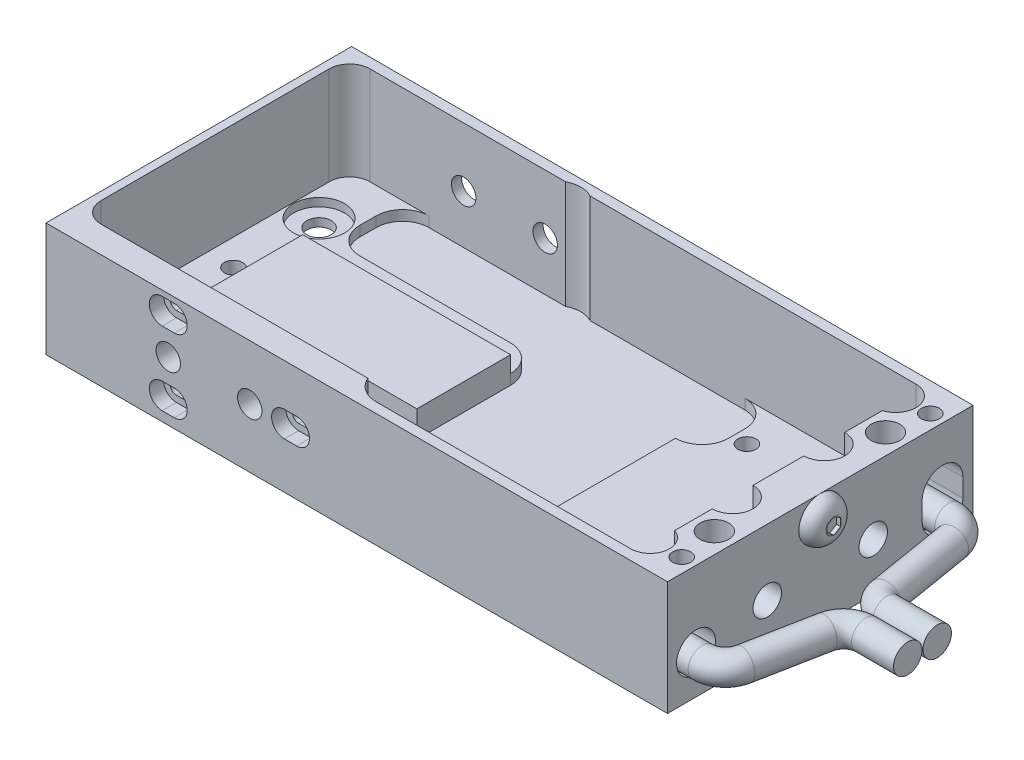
SolidWorks part; units mm, degrees
ref_plane "Front Plane" through (0, 0, 0) normal (0, 0, 1) x (1, 0, 0)
ref_plane "Top Plane" through (0, 0, 0) normal (0, 1, 0) x (1, 0, 0)
ref_plane "Right Plane" through (0, 0, 0) normal (1, 0, 0) x (0, 0, -1)
sketch "Sketch1" plane through (0, 0, 0) normal (0, 1, 0) x (1, 0, 0)
  line L1 (0, 0) -> (77.47, 0)
  line L2 (0, 0) -> (0, 38.1)
  line L3 (0, 38.1) -> (77.47, 38.1)
  line L4 (77.47, 0) -> (77.47, 38.1)
  dimension "D1" = 38.1
  dimension "D2" = 77.47
extrude "Base" add sketch "Sketch1" against normal blind 14.224
sketch "Hole Locations" plane through (0, 0, 0) normal (0, 1, 0) x (1, 0, 0)
  line L0 (0, 19.05) -> (75.692, 19.05) construction
  line L1 (0, 38.1) -> (0, 0) construction
  line L3 (4.318, 19.05) -> (4.318, 0) construction
  line L4 (0, 0) -> (77.47, 0) construction
  line L5 (11.43, 19.05) -> (11.43, 0) construction
  line L6 (30.48, 19.05) -> (30.48, 0) construction
  line L7 (55.372, 32.004) -> (55.372, 19.05) construction
  line L8 (55.372, 19.05) -> (55.372, 6.096) construction
  line L9 (69.596, 19.05) -> (69.596, 8.382) construction
  line L10 (69.596, 19.05) -> (69.596, 29.718) construction
  line L11 (75.692, 34.544) -> (75.692, 3.556) construction
  dimension "D1" = 19.05
  dimension "D2" = 4.318
  dimension "D3" = 11.43
  dimension "D4" = 30.48
  dimension "D5" = 55.372
  dimension "D6" = 6.096
  dimension "D7" = 69.596
  dimension "D8" = 8.382
  dimension "D9" = 75.692
  dimension "D10" = 3.556
hole_wizard "#4-40 Tapped Hole1" positions "3DSketch1" profile "Sketch3" tap size "#4-40" standard "Ansi Inch"
sketch3d "3DSketch1"
  point P0 (4.318, 0, -19.05)
  point P3 (11.43, 0, -19.05)
  point P6 (30.48, 0, -19.05)
  point P9 (55.372, 0, -32.004)
  point P12 (55.372, 0, -6.096)
  point P15 (69.596, 0, -29.718)
  point P18 (69.596, 0, -8.382)
  point P21 (75.692, 0, -3.556)
  point P24 (75.692, 0, -34.544)
sketch "Sketch3" plane through (4.318, 0, -19.05) normal (1, 0, 0) x (0, 0, 1)
  line L0 (0, 0) -> (0, 14.224)
  line L1 (0, 14.224) -> (1.1303, 14.224)
  line L2 (1.1303, 14.224) -> (1.1303, 0)
  line L5 (1.1303, 0) -> (0, 0)
  line L11 (0, -6.35) -> (0, 107.95) construction
  dimension "Thru Tap Drill Dia." = 2.2606
  dimension "Thru Tap Drill Depth" = 14.224
sketch "Sketch4" plane through (0, 0, 0) normal (0, 1, 0) x (1, 0, 0)
  line L1 (0, 0) -> (77.47, 0) construction
  circle A0 centre (74.93, 29.718) radius 1.778
  circle A1 centre (74.93, 8.382) radius 1.778
  dimension "D1" = 3.556
  dimension "D2" = 8.382
  dimension "D3" = 29.718
  dimension "D4" = 74.93
extrude "2 Thru Holes" cut sketch "Sketch4" against normal through all
sketch "Sketch5" plane through (0, 0, 0) normal (0, 1, 0) x (1, 0, 0)
  line L0 (50.292, 1.27) -> (39.878, 1.27)
  line L1 (7.62, 31.496) -> (7.62, 6.604) construction
  line L2 (10.922, 9.906) -> (29.718, 9.906)
  line L3 (33.02, 13.208) -> (33.02, 24.892)
  line L4 (29.718, 28.194) -> (10.922, 28.194)
  line L5 (7.62, 31.496) -> (7.62, 33.528)
  line L6 (10.922, 36.83) -> (27.9242, 36.83)
  line L7 (31.0038, 36.83) -> (50.292, 36.83)
  line L8 (53.594, 33.528) -> (53.594, 31.496)
  line L9 (50.292, 28.194) -> (50.292, 9.906)
  line L10 (53.594, 6.604) -> (53.594, 4.572)
  line L11 (27.9242, 36.83) -> (31.0038, 36.83) construction
  line L12 (29.464, 36.83) -> (29.464, 37.211) construction
  line L13 (36.83, 3.302) -> (10.922, 3.302)
  line L14 (0, 0) -> (77.47, 0) construction
  line L15 (0, 38.1) -> (0, 0) construction
  arc A0 (10.922, 3.302) -> (10.922, 9.906) centre (10.922, 6.604) cw
  arc A2 (29.718, 9.906) -> (33.02, 13.208) centre (29.718, 13.208) ccw
  arc A3 (33.02, 24.892) -> (29.718, 28.194) centre (29.718, 24.892) ccw
  arc A4 (10.922, 28.194) -> (7.62, 31.496) centre (10.922, 31.496) cw
  arc A5 (7.62, 33.528) -> (10.922, 36.83) centre (10.922, 33.528) cw
  arc A6 (27.9242, 36.83) -> (31.0038, 36.83) centre (29.464, 33.909) cw
  arc A7 (50.292, 36.83) -> (53.594, 33.528) centre (50.292, 33.528) cw
  arc A8 (53.594, 31.496) -> (50.292, 28.194) centre (50.292, 31.496) cw
  arc A9 (50.292, 9.906) -> (53.594, 6.604) centre (50.292, 6.604) cw
  arc A10 (53.594, 4.572) -> (50.292, 1.27) centre (50.292, 4.572) cw
  arc A11 (39.878, 1.27) -> (36.83, 3.302) centre (39.878, 4.572) cw
  dimension "D3" = 3.302
  dimension "D1" = 0.381
  dimension "D2" = 29.464
  dimension "D4" = 1.27
  dimension "D5" = 3.302
  dimension "D6" = 9.906
  dimension "D7" = 28.194
  dimension "D8" = 36.83
  dimension "D9" = 10.922
  dimension "D10" = 50.292
  dimension "D11" = 33.02
  dimension "D12" = 36.83
extrude "0.53 DP" cut sketch "Sketch5" against normal blind 13.462
sketch "Sketch6" plane through (0, 0, 0) normal (0, 1, 0) x (1, 0, 0)
  line L0 (50.292, 36.83) -> (71.628, 36.83)
  line L1 (71.628, 31.75) -> (65.786, 31.75)
  line L2 (65.786, 31.75) -> (65.786, 27.178)
  line L3 (65.786, 27.178) -> (72.39, 27.178)
  line L4 (72.39, 22.098) -> (72.39, 15.748)
  line L5 (72.39, 10.668) -> (65.786, 10.668)
  line L6 (65.786, 10.668) -> (65.786, 6.096)
  line L7 (65.786, 6.096) -> (71.628, 6.096)
  line L8 (71.628, 1.27) -> (50.292, 1.27)
  line L9 (50.292, 1.27) -> (50.292, 36.83)
  line L10 (0, 0) -> (77.47, 0) construction
  line L11 (65.786, 8.382) -> (77.47, 8.382) construction
  line L12 (77.47, 0) -> (77.47, 38.1) construction
  line L13 (10.922, 36.83) -> (3.556, 36.83)
  line L14 (1.016, 34.29) -> (1.016, 5.842)
  line L15 (3.556, 3.302) -> (36.83, 3.302)
  line L17 (0, 38.1) -> (0, 0) construction
  line L18 (10.922, 36.83) -> (36.83, 36.83)
  line L19 (50.292, 36.83) -> (31.0038, 36.83) construction
  line L20 (36.83, 36.83) -> (36.83, 3.302)
  arc A0 (71.628, 36.83) -> (71.628, 31.75) centre (71.628, 34.29) cw
  arc A1 (72.39, 27.178) -> (72.39, 22.098) centre (72.39, 24.638) cw
  arc A2 (72.39, 10.668) -> (72.39, 15.748) centre (72.39, 13.208) ccw
  arc A3 (71.628, 6.096) -> (71.628, 1.27) centre (71.628, 3.683) cw
  arc A4 (3.556, 36.83) -> (1.016, 34.29) centre (3.556, 34.29) ccw
  arc A5 (1.016, 5.842) -> (3.556, 3.302) centre (3.556, 5.842) ccw
  dimension "D1" = 2.54
  dimension "D2" = 72.39
  dimension "D3" = 65.786
  dimension "D4" = 6.096
  dimension "D5" = 71.628
  dimension "D6" = 8.382
  dimension "D7" = 1.016
extrude "0.48 DP" cut sketch "Sketch6" against normal blind 12.192
sketch "Sketch7" plane through (0, -12.192, 0) normal (0, 1, 0) x (1, 0, 0)
  line L0 (33.02, 13.208) -> (33.02, 24.892) construction
  line L1 (7.112, 24.892) -> (33.02, 24.892)
  line L2 (7.112, 24.892) -> (7.112, 13.208)
  line L3 (7.112, 13.208) -> (33.02, 13.208)
  line L4 (33.02, 24.892) -> (33.02, 13.208)
  dimension "D1" = 7.112
extrude "0.40 DP" add sketch "Sketch7" along normal blind 2.032
sketch "CB Locations" plane through (0, 0, 0) normal (0, 1, 0) x (1, 0, 0)
  line L0 (4.318, 19.05) -> (4.318, 29.718) construction
  line L1 (4.318, 19.05) -> (4.318, 8.382) construction
  dimension "D1" = 4.318
  dimension "D2" = 8.382
  dimension "D3" = 29.718
hole_wizard "Counterbores" positions "Sketch9" profile "Sketch8" legacy
sketch "Sketch9" plane through (-3.447, 0, -18.161) normal (0, 1, 0) x (-1, 0, 0)
  point P0 (-7.765, -11.557)
  point P4 (-7.765, 9.779)
sketch "Sketch8" plane through (4.318, 0, -29.718) normal (1, 0, 0) x (0, 0, 1)
  line L0 (0, 0) -> (0, 14.224)
  line L1 (0, 14.224) -> (1.524, 14.224)
  line L2 (1.524, 14.224) -> (1.524, 13.208)
  line L3 (1.524, 13.208) -> (3.175, 13.208)
  line L4 (3.175, 13.208) -> (3.175, 0)
  line L5 (3.175, 0) -> (0, 0)
  line L6 (0, 110) -> (0, -10) construction
  dimension "Diameter" = 3.048
  dimension "Depth" = 14.224
  dimension "C-Bore Diameter" = 6.35
  dimension "C-Bore Depth" = 13.208
sketch "Sketch11" plane through (0, 0, 0) normal (0, 1, 0) x (-1, 0, 0)
  line L0 (-72.39, -15.748) -> (-72.39, -22.098) construction
  line L1 (-65.786, -31.867) -> (-72.39, -31.867)
  line L2 (-65.786, -31.867) -> (-65.786, -5.9725)
  line L3 (-65.786, -5.9725) -> (-72.39, -5.9725)
  line L4 (-72.39, -31.867) -> (-72.39, -5.9725)
  line L5 (-65.786, -27.178) -> (-65.786, -31.75) construction
  arc A1 (-71.628, -1.27) -> (-71.628, -6.096) centre (-71.628, -3.683) ccw construction
  arc A2 (-71.628, -31.75) -> (-71.628, -36.83) centre (-71.628, -34.29) ccw construction
extrude "Shelf 0.40 DP" cut sketch "Sketch11" against normal blind 10.16
sketch "Sketch12" plane through (0, 0, -38.1) normal (0, 0, -1) x (-1, 0, 0)
  circle A0 centre (-15.24, -7.366) radius 1.524
  circle A1 centre (-25.4, -7.366) radius 1.524
  dimension "D1" = 3.048
  dimension "D2" = 7.366
  dimension "D3" = 15.24
  dimension "D4" = 25.4
extrude "2 Side Holes" cut sketch "Sketch12" against normal up to next
sketch "Sketch13" plane through (0, 0, 0) normal (0, 0, 1) x (1, 0, 0)
  line L0 (29.718, -6.858) -> (31.242, -6.858) construction
  line L1 (29.718, -6.0579) -> (31.242, -6.0579)
  line L2 (29.718, -7.6581) -> (31.242, -7.6581)
  line L3 (15.24, -6.858) -> (25.4, -6.858) construction
  line L4 (14.478, -2.286) -> (16.002, -2.286) construction
  line L5 (14.478, -1.4859) -> (16.002, -1.4859)
  line L6 (14.478, -3.0861) -> (16.002, -3.0861)
  line L7 (14.478, -11.43) -> (16.002, -11.43) construction
  line L8 (14.478, -10.6299) -> (16.002, -10.6299)
  line L9 (14.478, -12.2301) -> (16.002, -12.2301)
  line L10 (25.4, -6.858) -> (29.718, -6.858) construction
  line L11 (15.24, -2.286) -> (15.24, -6.858) construction
  line L15 (0, 0) -> (0, -14.224) construction
  line L17 (15.24, -6.858) -> (15.24, -11.43) construction
  arc A0 (29.718, -6.0579) -> (29.718, -7.6581) centre (29.718, -6.858) ccw
  arc A1 (31.242, -7.6581) -> (31.242, -6.0579) centre (31.242, -6.858) ccw
  arc A2 (14.478, -1.4859) -> (14.478, -3.0861) centre (14.478, -2.286) ccw
  arc A3 (16.002, -3.0861) -> (16.002, -1.4859) centre (16.002, -2.286) ccw
  arc A4 (14.478, -10.6299) -> (14.478, -12.2301) centre (14.478, -11.43) ccw
  arc A5 (16.002, -12.2301) -> (16.002, -10.6299) centre (16.002, -11.43) ccw
  circle A6 centre (25.4, -6.858) radius 1.524
  circle A7 centre (15.24, -6.858) radius 1.524
  circle A8 centre (15.24, -7.366) radius 1.524 construction
  point P2 (30.48, -6.858)
  point P13 (15.24, -2.286)
  point P20 (15.24, -11.43)
  dimension "D1" = 0.8001
  dimension "D2" = 1.524
  dimension "D3" = 30.48
  dimension "D4" = 2.286
  dimension "D5" = 11.43
  dimension "D6" = 14.224
  dimension "D7" = 6.858
  dimension "D8" = 15.24
  dimension "D9" = 25.4
extrude "5 Side Holes" cut sketch "Sketch13" against normal up to next
sketch "Sketch14" plane through (0, 0, 0) normal (0, 0, 1) x (1, 0, 0)
  line L0 (14.478, -2.286) -> (16.002, -2.286) construction
  line L1 (14.478, -0.6858) -> (16.002, -0.6858)
  line L2 (14.478, -3.8862) -> (16.002, -3.8862)
  line L3 (14.478, -11.43) -> (16.002, -11.43) construction
  line L4 (14.478, -9.8298) -> (16.002, -9.8298)
  line L5 (14.478, -13.0302) -> (16.002, -13.0302)
  line L6 (29.718, -6.858) -> (31.242, -6.858) construction
  line L7 (29.718, -5.2578) -> (31.242, -5.2578)
  line L8 (29.718, -8.4582) -> (31.242, -8.4582)
  arc A0 (14.478, -0.6858) -> (14.478, -3.8862) centre (14.478, -2.286) ccw
  arc A1 (16.002, -3.8862) -> (16.002, -0.6858) centre (16.002, -2.286) ccw
  arc A2 (16.002, -3.0861) -> (16.002, -1.4859) centre (16.002, -2.286) ccw construction
  arc A3 (14.478, -9.8298) -> (14.478, -13.0302) centre (14.478, -11.43) ccw
  arc A4 (16.002, -13.0302) -> (16.002, -9.8298) centre (16.002, -11.43) ccw
  arc A5 (14.478, -10.6299) -> (14.478, -12.2301) centre (14.478, -11.43) ccw construction
  arc A6 (16.002, -12.2301) -> (16.002, -10.6299) centre (16.002, -11.43) ccw construction
  arc A7 (29.718, -5.2578) -> (29.718, -8.4582) centre (29.718, -6.858) ccw
  arc A8 (31.242, -8.4582) -> (31.242, -5.2578) centre (31.242, -6.858) ccw
  arc A9 (31.242, -7.6581) -> (31.242, -6.0579) centre (31.242, -6.858) ccw construction
  arc A10 (29.718, -6.0579) -> (29.718, -7.6581) centre (29.718, -6.858) ccw construction
  point P3 (15.24, -2.286)
  point P13 (15.24, -11.43)
  point P26 (30.48, -6.858)
  dimension "D1" = 1.6002
  dimension "D2" = 1.6002
  dimension "D3" = 1.6002
extrude "Slot CBs" cut sketch "Sketch14" against normal blind 1.778
sketch "Sketch15" plane through (77.47, 0, 0) normal (1, 0, 0) x (0, 0, -1)
  line L0 (34.29, -7.112) -> (34.29, -9.398) construction
  line L1 (36.83, -7.112) -> (36.83, -9.398)
  line L2 (31.75, -7.112) -> (31.75, -9.398)
  line L3 (34.29, -4.572) -> (43.6694, -4.572) construction
  line L4 (43.6694, -4.572) -> (43.6694, -11.938) construction
  line L5 (43.6694, -11.938) -> (34.29, -11.938) construction
  line L6 (0, 0) -> (38.1, 0) construction
  arc A0 (36.83, -7.112) -> (31.75, -7.112) centre (34.29, -7.112) ccw
  arc A1 (31.75, -9.398) -> (36.83, -9.398) centre (34.29, -9.398) ccw
  circle A2 centre (25.654, -8.255) radius 1.778
  circle A3 centre (12.446, -8.255) radius 1.778
  circle A4 centre (3.556, -9.398) radius 2.4257
  point P2 (34.29, -8.255)
  dimension "D1" = 2.54
  dimension "D9" = 3.556
  dimension "D10" = 4.8514
  dimension "D2" = 4.572
  dimension "D3" = 11.938
  dimension "D4" = 8.255
  dimension "D5" = 31.75
  dimension "D6" = 36.83
  dimension "D7" = 25.654
  dimension "D8" = 12.446
  dimension "D11" = 3.556
  dimension "D12" = 9.398
extrude "Short Side Thrus" cut sketch "Sketch15" against normal blind 6.096
sketch3d "3DSketch4"
  line L0 (0, 0, -19.05) -> (77.47, 0, -19.05) construction
  line L1 (0, 0, -38.1) -> (0, 0, 0) construction
  line L2 (77.47, 0, 0) -> (77.47, 0, -38.1) construction
sketch "Sketch16" plane through (0, 0, -19.05) normal (0, 0, 1) x (1, 0, 0)
  line L0 (77.47, 0) -> (77.47, -2.6734)
  line L1 (79.1523, -1.6823) -> (79.1523, -2.6734)
  line L4 (77.47, -2.6734) -> (80.1699, -2.6734) construction
  line L5 (79.248, 0.254) -> (77.47, 0.254) construction
  line L6 (77.47, 0.254) -> (77.47, 0) construction
  line L7 (77.47, -2.6734) -> (79.1523, -2.6734)
  arc A0 (77.47, 0) -> (79.1523, -1.6823) centre (77.47, -1.6823) cw
revolve "Screw" add sketch "Sketch16" angle 360 about L4
sketch "Sketch17" plane through (79.1523, 0, 0) normal (1, 0, 0) x (0, 0, -1)
  line L1 (19.9083, -3.1689) -> (19.9083, -2.1778)
  line L2 (19.9083, -2.1778) -> (19.05, -1.6823)
  line L3 (19.05, -1.6823) -> (18.1917, -2.1778)
  line L4 (18.1917, -2.1778) -> (18.1917, -3.1689)
  line L5 (18.1917, -3.1689) -> (19.05, -3.6644)
  line L6 (19.05, -3.6644) -> (19.9083, -3.1689)
  circle A0 centre (19.05, -2.6734) radius 0.8583 construction
  circle A1 centre (19.05, -2.6734) radius 0.9911 construction
extrude "Screw Hex" cut sketch "Sketch17" against normal blind 0.508
sketch "Sketch18" plane through (0, -14.224, 0) normal (0, -1, 0) x (1, 0, 0)
  line L0 (77.47, -34.4322) -> (78.2599, -34.4322)
  line L1 (77.47, -19.05) -> (77.47, -38.1) construction
  line L2 (81.0732, -32.0463) -> (82.739, -21.9842)
  line L3 (84.4286, -20.5514) -> (90.6885, -20.5514)
  line L4 (77.47, -34.4322) -> (65.786, -34.4322)
  line L5 (65.786, -34.4322) -> (65.786, -31.75) construction
  arc A0 (78.2599, -34.4322) -> (81.0732, -32.0463) centre (78.2599, -31.5805) ccw
  arc A1 (82.739, -21.9842) -> (84.4286, -20.5514) centre (84.4286, -22.264) cw
sketch "Sketch19" plane through (72.39, 0, 0) normal (-1, 0, 0) x (0, 0, 1)
  line L0 (-34.29, -12.192) -> (-34.29, 0) construction
  circle A0 centre (-34.29, -10.0311) radius 1.778
  dimension "D1" = 3.556
sweep "Cord" add profiles "Sketch19" path "Sketch18"
sketch "Sketch21" plane through (72.39, 0, 0) normal (-1, 0, 0) x (0, 0, 1)
  line L0 (-3.5674, -8.2531) -> (-20.4092, -8.2531) construction
  circle A0 centre (-3.5674, -10.0312) radius 1.7781
  circle A1 centre (-20.4092, -10.0311) radius 1.778 construction
sketch "Sketch20" plane through (0, -14.224, 0) normal (0, -1, 0) x (1, 0, 0)
  line L0 (85.4663, -16.7385) -> (90.6885, -16.7385)
  line L2 (90.6885, -22.1872) -> (90.6885, -18.6312) construction
  line L3 (78.2599, -3.5674) -> (65.786, -3.5674)
  line L4 (65.786, -3.5674) -> (65.786, -1.6009) construction
  line L5 (65.786, -6.096) -> (65.786, -10.668) construction
  line L6 (82.739, -14.4887) -> (81.0732, -5.8882)
  arc A0 (81.0732, -5.8882) -> (78.2599, -3.5674) centre (78.2599, -6.4331) ccw
  arc A1 (82.739, -14.4887) -> (85.4663, -16.7385) centre (85.4663, -13.9605) ccw
sweep "Cord2" add profiles "Sketch21" path "Sketch20"
